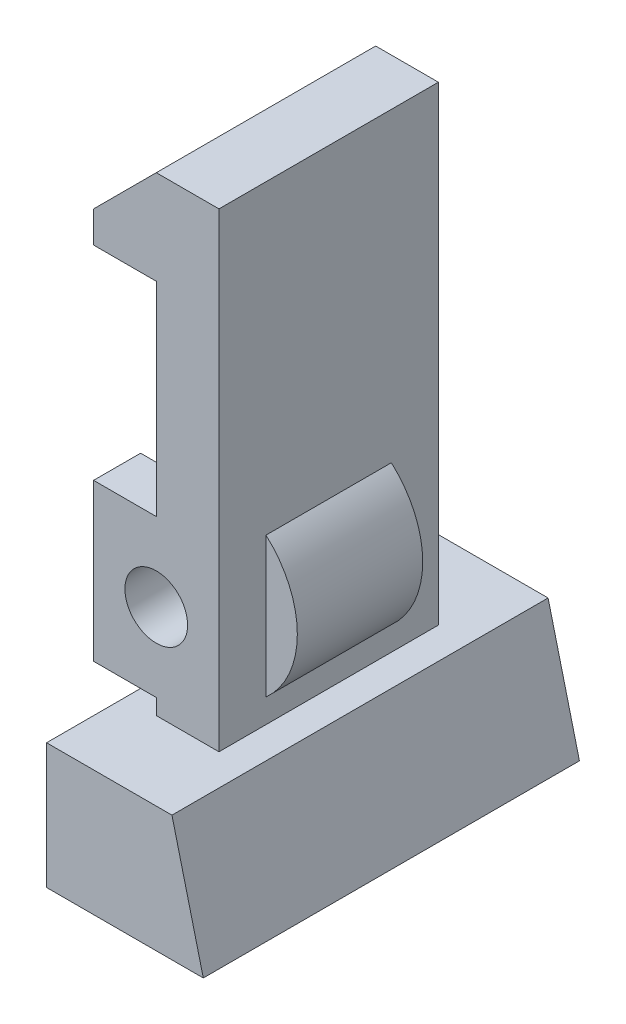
SolidWorks part; units mm, degrees
ref_plane "Face" through (0, 0, 0) normal (0, 0, 1) x (1, 0, 0)
ref_plane "Dessus" through (0, 0, 0) normal (0, 1, 0) x (1, 0, 0)
ref_plane "Droite" through (0, 0, 0) normal (1, 0, 0) x (0, 0, -1)
sketch "Esquisse2" plane through (0, 0, 0) normal (0, 0, 1) x (1, 0, 0)
  line L0 (0, 0) -> (0, 9)
  line L1 (0, 9) -> (-2, 9)
  line L2 (-2, 9) -> (-2, 10)
  line L3 (-2, 10) -> (0, 12)
  line L4 (0, 12) -> (2, 12)
  line L5 (2, 12) -> (2, -3)
  line L6 (2, -3) -> (0, -3)
  line L7 (0, -3) -> (0, 0)
  dimension "D1" = 2
  dimension "D2" = 2
  dimension "D3" = 3
  dimension "D4" = 45
  dimension "D5" = 9
  dimension "D6" = 15
extrude "Clip" add sketch "Esquisse2" along normal mid plane 7
sketch "Esquisse3" plane through (0, 0, 0) normal (0, 0, 1) x (1, 0, 0)
  line L0 (2, -3) -> (3, -3)
  line L1 (3, -3) -> (4, -7)
  line L2 (0, -3) -> (2, -3)
  line L3 (4, -7) -> (-1, -7)
  line L4 (-1, -7) -> (-1, -3)
  line L5 (-1, -3) -> (0, -3)
  dimension "D1" = 4
  dimension "D2" = 5
  dimension "D3" = 4
extrude "Talon" add sketch "Esquisse3" along normal mid plane 12
sketch "Esquisse4" plane through (0, 0, 0) normal (0, 0, 1) x (1, 0, 0)
  line L0 (0, 3) -> (0, -3)
  arc A0 (0, -3) -> (0, 3) centre (0, 0) ccw
  dimension "D1" = 3
extrude "Bosse arrière" add sketch "Esquisse4" along normal mid plane 4
sketch "Esquisse5" plane through (0, 0, 3.5) normal (0, 0, 1) x (1, 0, 0)
  line L0 (0, 9) -> (0, -3) construction
  line L1 (0, 2.5) -> (0, -2.5)
  line L2 (0, 2.5) -> (-2, 2.5)
  line L3 (-2, 2.5) -> (-2, -2.5)
  line L4 (-2, -2.5) -> (0, -2.5)
  line L5 (0, 0) -> (-2, 0) construction
  dimension "D1" = 5
  dimension "D2" = 2
extrude "Butée avant" add sketch "Esquisse5" against normal blind 1.5
mirror "Symétrie1" about plane through (0, 0, 0) normal (0, 0, 1)
sketch "Esquisse6" plane through (0, 0, 0) normal (0, 0, 1) x (1, 0, 0)
  circle A0 centre (0, 0) radius 1
  dimension "D1" = 2
extrude "Trou axe" cut sketch "Esquisse6" against normal through all and the other way through all
